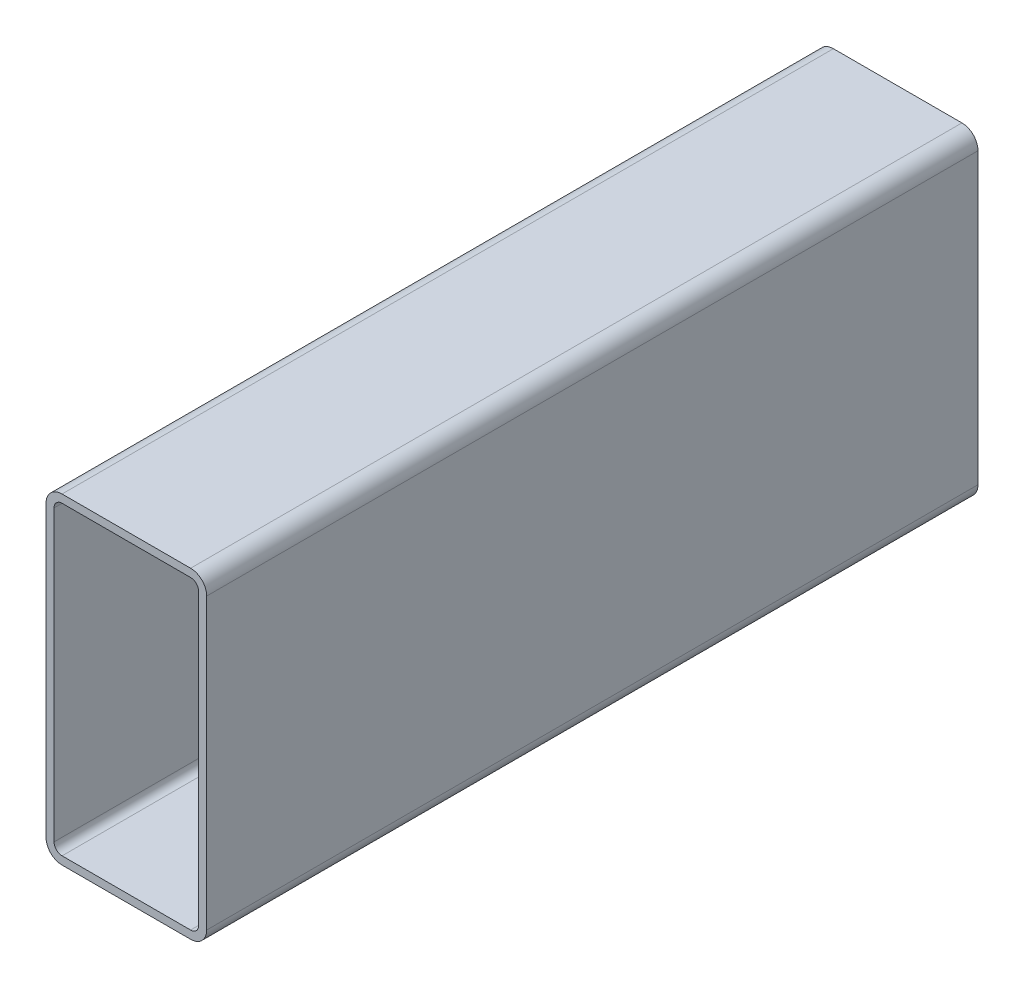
SolidWorks part; units mm, degrees
ref_plane "Front Plane" through (0, 0, 0) normal (0, 0, 1) x (1, 0, 0)
ref_plane "Top Plane" through (0, 0, 0) normal (0, 1, 0) x (1, 0, 0)
ref_plane "Right Plane" through (0, 0, 0) normal (1, 0, 0) x (0, 0, -1)
sketch "Sketch1" plane through (0, 0, 0) normal (0, 0, 1) x (1, 0, 0)
sketch_block_instance "HSS5x2.5x0.125-1"
sketch_block "HSS5x2.5x0.125"
extrude "Boss-Extrude1" add sketch "Sketch1" along normal blind 304.8
